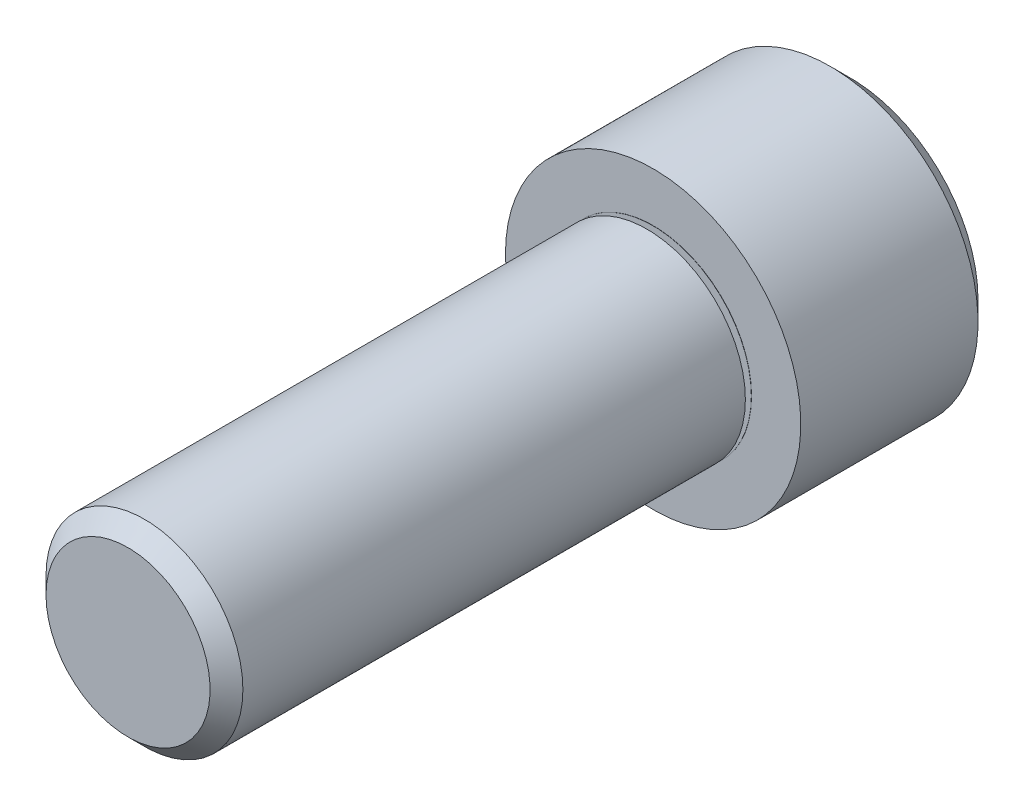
SolidWorks part; units mm, degrees
ref_plane "Front" through (0, 0, 0) normal (0, 0, 1) x (1, 0, 0)
ref_plane "Top" through (0, 0, 0) normal (0, 1, 0) x (1, 0, 0)
ref_plane "Right" through (0, 0, 0) normal (1, 0, 0) x (0, 0, -1)
sketch "Logo3_Revol_Axis" plane through (0, 0, 0) normal (0, 1, 0) x (1, 0, 0)
  line L0 (0, -43.5172) -> (0, 43.5172) construction
sketch "Logo3_bib1" plane through (0, 0, 0) normal (0, -1, 0) x (-1, 0, 0)
  line L0 (0, -25.4) -> (0, 9.525)
  line L1 (0, 9.525) -> (6.1913, 9.525)
  line L2 (7.1438, 8.5725) -> (7.1438, 0)
  line L3 (7.1438, 0) -> (4.7625, 0)
  line L4 (4.7625, 0) -> (4.7625, -0.01)
  line L5 (4.7625, -24.6063) -> (3.9688, -25.4)
  line L6 (3.9688, -25.4) -> (0, -25.4)
  line L7 (4.7625, -0.01) -> (4.0822, -0.01)
  line L8 (4.0753, -0.0488) -> (4.7625, -0.2989)
  line L9 (4.7625, -0.2989) -> (4.7625, -24.6063)
  line L10 (0, 10.5852) -> (0, -63.2873) construction
  line L11 (6.1913, 9.525) -> (7.1438, 8.5725)
  arc A1 (4.0822, -0.01) -> (4.0753, -0.0488) centre (4.0822, -0.03) ccw
  point P17 (3.9688, -0.01)
  point P19 (7.1438, 9.525)
revolve "Revolve1" add sketch "Logo3_bib1" angle 360 about L10
sketch "Logo3_bib2" plane through (0, 0, -9.525) normal (0, 0, -1) x (1, 0, 0)
  line L1 (4.5754, 0) -> (2.2877, 3.9624)
  line L2 (2.2877, 3.9624) -> (-2.2877, 3.9624)
  line L3 (-2.2877, 3.9624) -> (-4.5754, 0)
  line L4 (-4.5754, 0) -> (-2.2877, -3.9624)
  line L5 (-2.2877, -3.9624) -> (2.2877, -3.9624)
  line L6 (2.2877, -3.9624) -> (4.5754, 0)
  circle A0 centre (0, 0) radius 3.9624 construction
  dimension "Logo3_c1" = 7.9248
extrude "Cut-Extrude1" cut sketch "Logo3_bib2" against normal blind 4.7625
equation "\"DIA2@Logo3_bib1\" = \"Logo3_d1-pas@Logo3_bib1\""
equation "\"LGT1@Logo3_bib1\" = \"Logo3_d1@Logo3_bib1\""
equation "\"D1@Cut-Extrude1\" = \"Logo3_d1@Logo3_bib1\"/2."
equation "\"D2@Cosmetic Thread1\" = \"Logo3_d1-pas@Logo3_bib1\""
equation "\"D5@Logo3_bib1\"=\"Logo3_d1@Logo3_bib1\"*.1"
